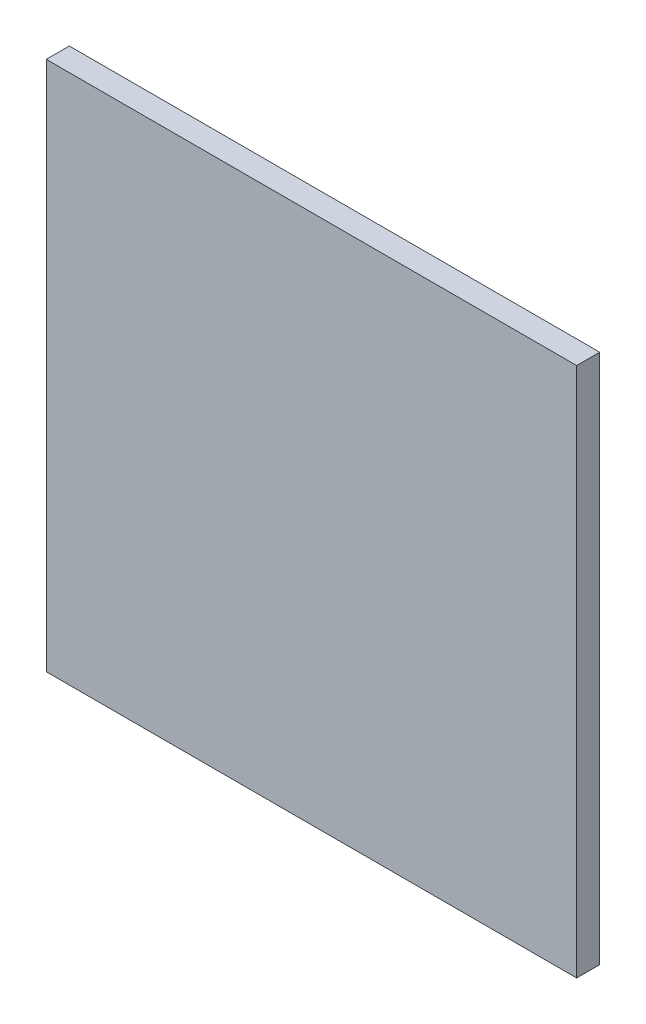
SolidWorks part; units mm, degrees
ref_plane "前视基准面" through (0, 0, 0) normal (0, 0, 1) x (1, 0, 0)
ref_plane "上视基准面" through (0, 0, 0) normal (0, 1, 0) x (1, 0, 0)
ref_plane "右视基准面" through (0, 0, 0) normal (1, 0, 0) x (0, 0, -1)
other "Configuration Table"
sketch "草图1" plane through (0, 0, 0) normal (0, 0, 1) x (1, 0, 0)
  line L1 (92, -92) -> (-92, -92)
  line L2 (92, -92) -> (92, 92)
  line L3 (92, 92) -> (-92, 92)
  line L4 (-92, -92) -> (-92, 92)
  line L5 (92, -92) -> (-92, 92) construction
  line L6 (92, 92) -> (-92, -92) construction
  point P0 (0, 0)
  dimension "D1" = 184
  dimension "D2" = 184
extrude "凸台-拉伸1" add sketch "草图1" along normal blind 8
